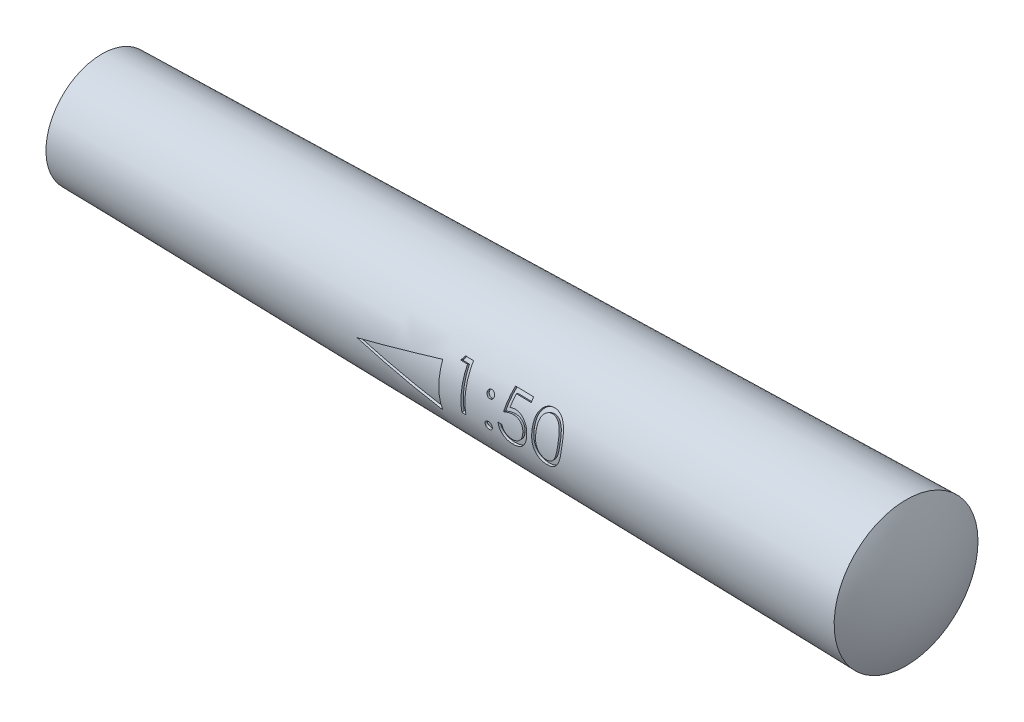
SolidWorks part; units mm, degrees
ref_plane "Front Plane" through (0, 0, 0) normal (0, 0, 1) x (1, 0, 0)
ref_plane "Top Plane" through (0, 0, 0) normal (0, 1, 0) x (1, 0, 0)
ref_plane "Right Plane" through (0, 0, 0) normal (1, 0, 0) x (0, 0, -1)
sketch "Sketch1" plane through (0, 0, 0) normal (1, 0, 0) x (0, 0, -1)
  circle A0 centre (0, 0) radius 1.25
  dimension "D1" = 2.5
extrude "Extrude1" add sketch "Sketch1" along normal mid plane 18
draft "Draft1" type of draft neutral plane draft angle 1.146 faces to draft 1 parameters "D1"=1.146
sketch "Sketch2" plane through (0, 0, 0) normal (0, 0, 1) x (1, 0, 0)
  line L0 (-9, 0) -> (-9, 1.25)
  line L1 (-9, 1.25) -> (-9, -1.25) construction
  line L2 (-9, 0) -> (-9.4, 0)
  line L3 (-9.4, 0) -> (-9.4, -1.43) construction
  line L4 (9, 0) -> (9, 1.61)
  line L5 (9, -1.61) -> (9, 1.61) construction
  line L6 (9, 0) -> (9.4, 0)
  line L7 (9.4, 0) -> (9.4, -1.43) construction
  line L8 (-9, -1.25) -> (9, -1.61) construction
  arc A0 (-9.4, 0) -> (-9, 1.25) centre (-7.2469, 0) cw
  arc A1 (9.4, 0) -> (9, 1.61) centre (5.9598, 0) ccw
  point P14 (0, -1.43)
revolve "Revolve1" add sketch "Sketch2" angle 360 about L2
sketch "Sketch5" plane through (0, 0, 0) normal (0, 0, 1) x (1, 0, 0)
  line L0 (0, 1.43) -> (0, -1.43) construction
  line L1 (9, 1.61) -> (-9, 1.25) construction
  line L2 (-9, -1.25) -> (9, -1.61) construction
ref_plane "Plane2" through (0, 0, 0) normal (-0.02, 0, 0.9998) x (0.9998, 0, 0.02)
sketch "Sketch6" plane through (0, 0, 0) normal (-0.02, 0, 0.9998) x (0.9998, 0, 0.02)
  line L0 (0, 0) -> (0, 0.5)
  line L1 (0, 1.43) -> (0, -1.43) construction
  line L2 (0, 0.5) -> (-1.866, 0)
  line L3 (-1.866, 0) -> (0, -0.5)
  line L4 (0, -0.5) -> (0, 0)
  line L5 (0, -0.25) -> (3, -0.25) construction
  text T0 "1:50" font "Century Gothic" height 1
  dimension "D1" = 1
  dimension "D2" = 30
  dimension "D3" = 3
wrap "Wrap2" sketch "Sketch6" wrap type deboss source sketch "Sketch6" thickness 0.05 parameters "D1"=0.05
equation "\"D2@Sketch2\" = \"D1@Sketch2\""
